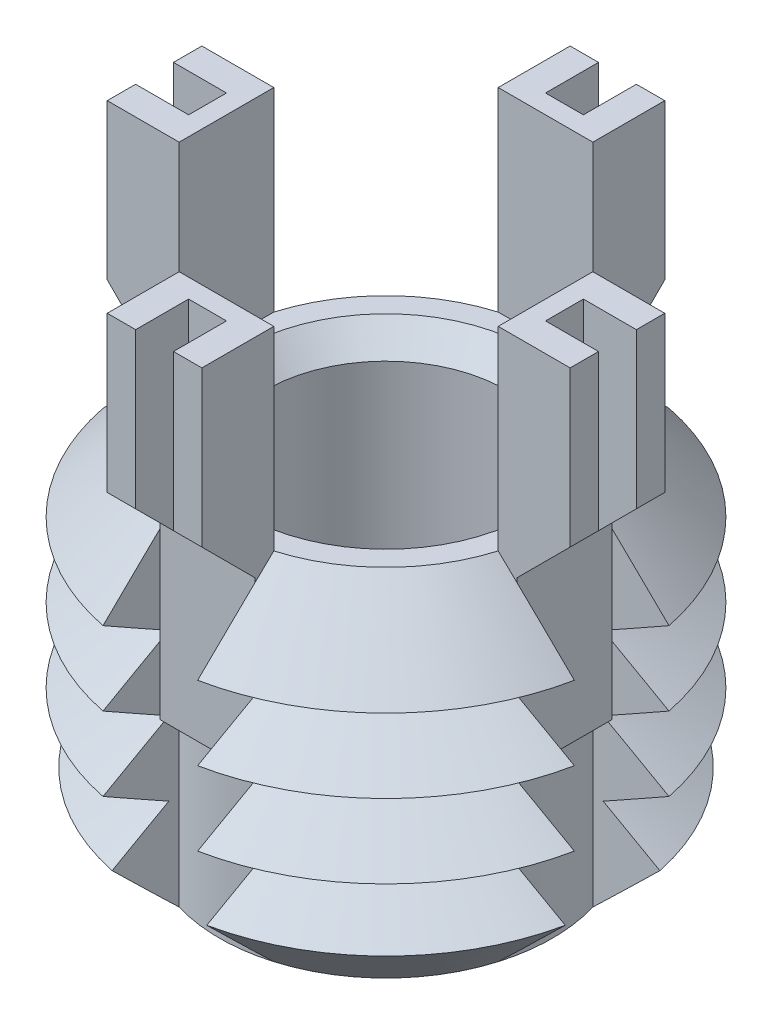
SolidWorks part; units mm, degrees
ref_plane "Front Plane" through (0, 0, 0) normal (0, 0, 1) x (1, 0, 0)
ref_plane "Top Plane" through (0, 0, 0) normal (0, 1, 0) x (1, 0, 0)
ref_plane "Right Plane" through (0, 0, 0) normal (1, 0, 0) x (0, 0, -1)
sketch "Sketch1" plane through (0, 0, 0) normal (0, 1, 0) x (1, 0, 0)
  circle A0 centre (0, 0) radius 6.35
  dimension "D1" = 12.7
extrude "Boss-Extrude1" add sketch "Sketch1" against normal blind 9.398
chamfer "Chamfer1" distance 1.954 angle 45 2 edges at (0, -9.398, 6.35) (0, 0, 6.35)
sketch "Sketch2" plane through (0, 0, 0) normal (1, 0, 0) x (0, 0, -1)
  line L0 (0, 0.8859) -> (0, -9.2617) construction
sketch "Sketch3" plane through (0, 0, 0) normal (1, 0, 0) x (0, 0, -1)
  line L0 (-6.35, -1.954) -> (-4.6578, -2.931)
  line L1 (-4.6578, -2.931) -> (-6.35, -3.908)
  line L2 (-6.35, -1.954) -> (-6.35, -7.444) construction
  line L3 (-6.35, -3.908) -> (-6.35, -1.954)
  dimension "D1" = 1.954
revolve "Cut-Revolve1" cut sketch "Sketch3" angle 360 about L0
pattern_linear "LPattern1" count 3 spacing 1.954 along (0, -1, 0) of "Cut-Revolve1"
sketch "Sketch4" plane through (0, 0, 0) normal (0, 1, 0) x (1, 0, 0)
  line L0 (-4.2145, 1.25) -> (-6.2258, 1.25)
  line L2 (-6.2258, -1.25) -> (-4.2145, -1.25)
  arc A0 (-4.2145, 1.25) -> (-4.2145, -1.25) centre (0, 0) ccw
  arc A1 (-6.2258, 1.25) -> (-6.2258, -1.25) centre (0, 0) ccw
  circle A2 centre (0, 0) radius 6.35 construction
  circle A3 centre (0, 0) radius 4.396 construction
  point P1 (-4.396, 0)
  point P3 (-6.35, 0)
  point P13 (0, 0)
  dimension "D1" = 2.5
extrude "Cut-Extrude1" cut sketch "Sketch4" against normal up to surface (9.398 mm away)
pattern_circular "CirPattern1" count 4 over 360 about axis through (0, 0, 0) along (0, 1, 0) of "Cut-Extrude1"
sketch "Sketch5" plane through (0, 0, 0) normal (1, 0, 0) x (0, 0, -1)
  line L0 (-4.2145, 5.138) -> (-4.2145, -4.862)
  line L1 (-4.2145, -4.862) -> (-4.7145, -4.862)
  line L2 (-4.7145, -4.862) -> (-4.7145, -0.362)
  line L3 (-4.7145, -0.362) -> (-6.1145, 1.038)
  line L4 (-6.1145, 1.038) -> (-6.1145, 5.138)
  line L5 (-6.1145, 5.138) -> (-4.2145, 5.138)
  line L6 (-6.2258, -5.862) -> (-1.25, -5.862) construction
  point P9 (-1.25, 0)
  point P10 (-4.7145, -0.362)
  dimension "D1" = 1
  dimension "D2" = 10
  dimension "D3" = 5.5
  dimension "D4" = 1.9
  dimension "D5" = 0.5
  dimension "D6" = 45
extrude "Boss-Extrude3" add sketch "Sketch5" along normal mid plane 2.5
pattern_circular "CirPattern2" count 4 over 360 about axis through (0, 0, 0) along (0, 1, 0) of "Boss-Extrude3"
sketch "Sketch6" plane through (0, 5.138, 0) normal (0, 1, 0) x (1, 0, 0)
  line L0 (-6.1145, -1.25) -> (-6.1145, 1.25) construction
  line L1 (-6.1145, -0.5) -> (-4.7145, -0.5)
  line L2 (-6.1145, -0.5) -> (-6.1145, 0.5)
  line L3 (-6.1145, 0.5) -> (-4.7145, 0.5)
  line L4 (-4.7145, -0.5) -> (-4.7145, 0.5)
  line L5 (-6.1145, -0.5) -> (-4.7145, 0.5) construction
  line L6 (-6.1145, 0.5) -> (-4.7145, -0.5) construction
  line L7 (6.1145, 1.25) -> (6.1145, -1.25) construction
  line L8 (-0.5, 4.7145) -> (0.5, 4.7145)
  line L9 (-0.5, 4.7145) -> (-0.5, 6.1145)
  line L10 (-0.5, 6.1145) -> (0.5, 6.1145)
  line L11 (0.5, 4.7145) -> (0.5, 6.1145)
  line L12 (-0.5, 4.7145) -> (0.5, 6.1145) construction
  line L13 (-0.5, 6.1145) -> (0.5, 4.7145) construction
  line L14 (4.7145, -0.5) -> (6.1145, -0.5)
  line L15 (4.7145, -0.5) -> (4.7145, 0.5)
  line L16 (4.7145, 0.5) -> (6.1145, 0.5)
  line L17 (6.1145, -0.5) -> (6.1145, 0.5)
  line L18 (4.7145, -0.5) -> (6.1145, 0.5) construction
  line L19 (4.7145, 0.5) -> (6.1145, -0.5) construction
  line L20 (-0.5, -6.1145) -> (0.5, -6.1145)
  line L21 (-0.5, -6.1145) -> (-0.5, -4.7145)
  line L22 (-0.5, -4.7145) -> (0.5, -4.7145)
  line L23 (0.5, -6.1145) -> (0.5, -4.7145)
  line L24 (-0.5, -6.1145) -> (0.5, -4.7145) construction
  line L25 (-0.5, -4.7145) -> (0.5, -6.1145) construction
  line L26 (-1.25, 6.1145) -> (1.25, 6.1145) construction
  line L27 (1.25, -6.1145) -> (-1.25, -6.1145) construction
  point P0 (-5.4145, 0)
  point P7 (-6.1145, 0)
  point P8 (-6.1145, 0)
  point P9 (0, 5.4145)
  point P14 (5.4145, 0)
  point P19 (0, -5.4145)
  point P24 (0, 6.1145)
  point P25 (6.1145, 0)
  point P26 (6.1145, 0)
  point P27 (0, 6.1145)
  point P30 (0, -6.1145)
  point P33 (0, -6.1145)
  dimension "D1" = 1
  dimension "D2" = 1.4
extrude "Cut-Extrude3" cut sketch "Sketch6" against normal through all both and the other way through all
sketch "Sketch7" plane through (0, 0, 0) normal (0, 1, 0) x (1, 0, 0)
  circle A0 centre (0, 0) radius 3.175
  dimension "D1" = 6.35
extrude "Cut-Extrude4" cut sketch "Sketch7" against normal up to surface (9.398 mm away)
chamfer "Chamfer2" distance 0.635 angle 45 2 edges at (0, 0, 3.175) (0, -9.398, 3.175)
